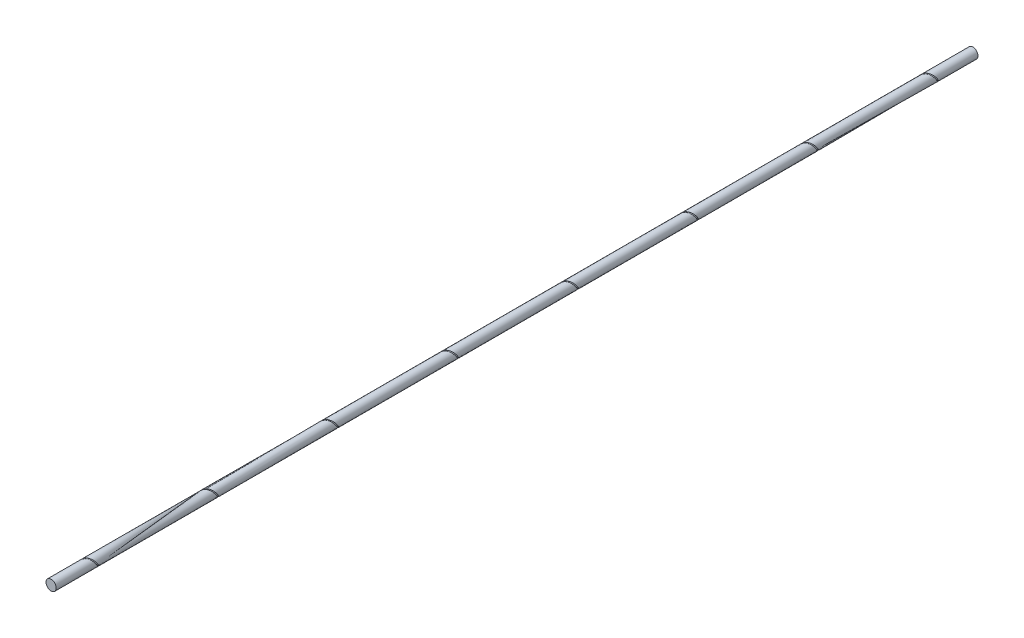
SolidWorks part; units mm, degrees
ref_plane "Front Plane" through (0, 0, 0) normal (0, 0, 1) x (1, 0, 0)
ref_plane "Top Plane" through (0, 0, 0) normal (0, 1, 0) x (1, 0, 0)
ref_plane "Right Plane" through (0, 0, 0) normal (1, 0, 0) x (0, 0, -1)
sketch "Sketch1" plane through (0, 0, 0) normal (0, 0, 1) x (1, 0, 0)
  circle A0 centre (0, 0) radius 25
  dimension "D1" = 50
extrude "Boss-Extrude1" add sketch "Sketch1" along normal blind 4500
ref_plane "Plane1" through (0, 0, 150) normal (0, 0, 1) x (1, 0, 0)
sketch "Sketch2" plane through (0, 0, 150) normal (0, 0, 1) x (1, 0, 0)
  circle A0 centre (0, 0) radius 27.646
  dimension "D1" = 55.292
curve "Helix/Spiral1"
sketch "Sketch3" plane through (0, 0, 0) normal (0, 1, 0) x (1, 0, 0)
  circle A0 centre (-27.646, -150) radius 3.969
  spline S0 degree 3 poles (-27.646, -150) (-27.646, -151.3307) (-27.0608, -154.0012) (-24.4828, -157.9997) (-20.3663, -162.0001) (-14.9702, -166) (-8.6335, -170) (-1.7543, -174) (5.2352, -178) (11.8957, -182) (17.8087, -186) (22.6028, -190) (25.9766, -194) (27.7183, -198) (27.7183, -202) (25.9766, -206) (22.6028, -210) (17.8087, -214) (11.8957, -218) (5.2352, -222) (-1.7543, -226) (-8.6335, -230) (-14.9702, -234) (-20.3663, -237.9999) (-24.4828, -242.0003) (-27.0608, -245.9988) (-27.646, -248.6693) (-27.646, -250) knots 0 0 0 0 0.04 0.08 0.12 0.16 0.2 0.24 0.28 0.32 0.36 0.4 0.44 0.48 0.52 0.56 0.6 0.64 0.68 0.72 0.76 0.8 0.84 0.88 0.92 0.96 1 1 1 1 construction
  dimension "D1" = 7.938
sweep "Cut-Sweep1" cut profiles "Sketch3" path "Helix/Spiral1"
pattern_linear "LPattern1" count 8 spacing 585.7143 along (0, 0, -1) of "Cut-Sweep1"
